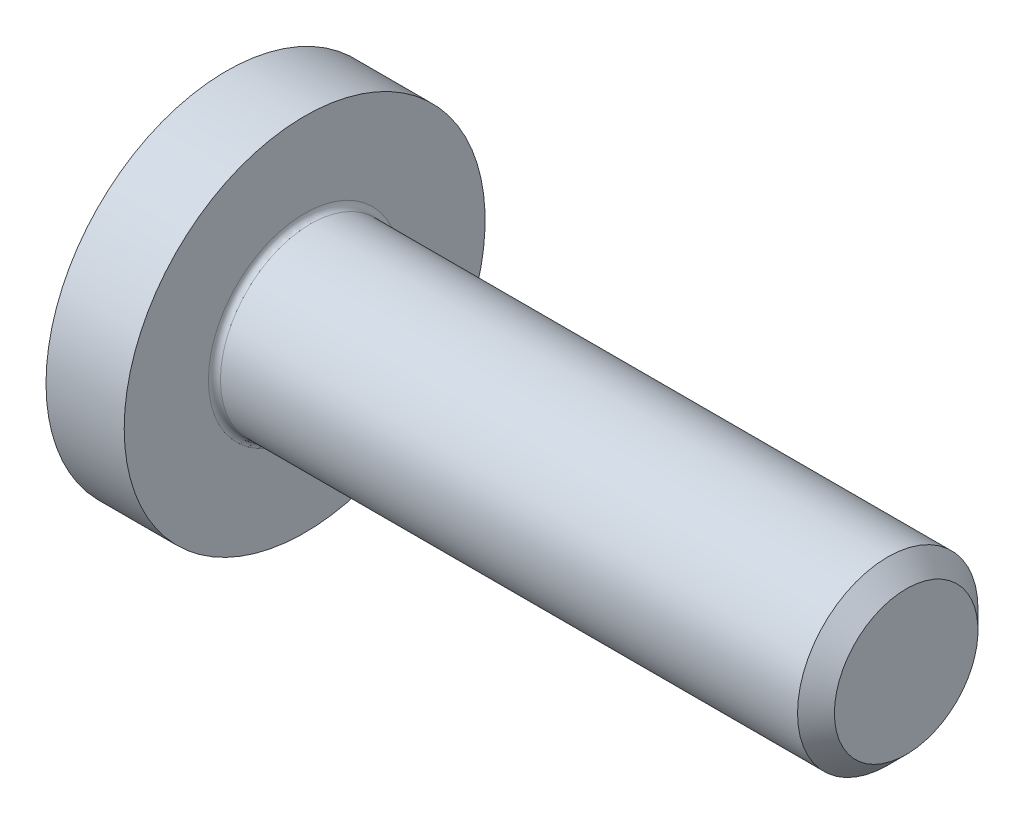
SolidWorks part; units mm, degrees
ref_plane "Front Plane" through (0, 0, 0) normal (0, 0, 1) x (1, 0, 0)
ref_plane "Top Plane" through (0, 0, 0) normal (0, 1, 0) x (1, 0, 0)
ref_plane "Right Plane" through (0, 0, 0) normal (1, 0, 0) x (0, 0, -1)
ref_plane "Plane1" through (0, 0, 0) normal (0, 0, 1) x (1, 0, 0)
sketch "Sketch1" plane through (0, 0, 0) normal (0, 0, 1) x (1, 0, 0)
  line L0 (-1.3, 0) -> (-1.3, 3)
  line L1 (-1.3, 3) -> (0, 3)
  line L2 (0, 3) -> (0, 1.6)
  line L3 (0.1, 1.5) -> (9.6935, 1.5)
  line L4 (9.6935, 1.5) -> (10, 1.1935)
  line L5 (10, 1.1935) -> (10, 0)
  line L6 (10, 0) -> (-1.3, 0)
  line L7 (10, 0) -> (-1.3, 0) construction
  arc A0 (0, 1.6) -> (0.1, 1.5) centre (0.1, 1.6) ccw
  dimension "D1" = 0.3065
  dimension "D2" = 135
  dimension "D3" = 10
  dimension "D4" = 1.3
revolve "Revolve1" add sketch "Sketch1" angle 360 about L7
ref_plane "Plane2" through (0, 0, 0) normal (0, 0, 1) x (1, 0, 0)
sketch "Sketch2" plane through (0, 0, 0) normal (0, 0, 1) x (1, 0, 0)
  line L0 (-1.3, 0) -> (-1.3, 0.75)
  line L1 (-1.3, 0.75) -> (0.7, 0.75)
  line L2 (0.7, 0.75) -> (1.133, 0)
  line L3 (1.133, 0) -> (-1.3, 0)
  line L4 (1.133, 0) -> (-1.3, 0) construction
revolve "Cut-Revolve1" cut sketch "Sketch2" angle 360 about L4
ref_plane "Plane3" through (-1.3, 0, 0) normal (1, 0, 0) x (0, 0, -1)
sketch "Sketch3" plane through (-1.3, 0, 0) normal (1, 0, 0) x (0, 0, -1)
  line L0 (-0.75, 0.433) -> (-0.75, -0.433)
  line L1 (-0.75, -0.433) -> (0, -0.866)
  line L2 (0, -0.866) -> (0.75, -0.433)
  line L3 (0.75, -0.433) -> (0.75, 0.433)
  line L4 (0.75, 0.433) -> (0, 0.866)
  line L5 (0, 0.866) -> (-0.75, 0.433)
extrude "Extrude1" cut sketch "Sketch3" along normal blind 2
